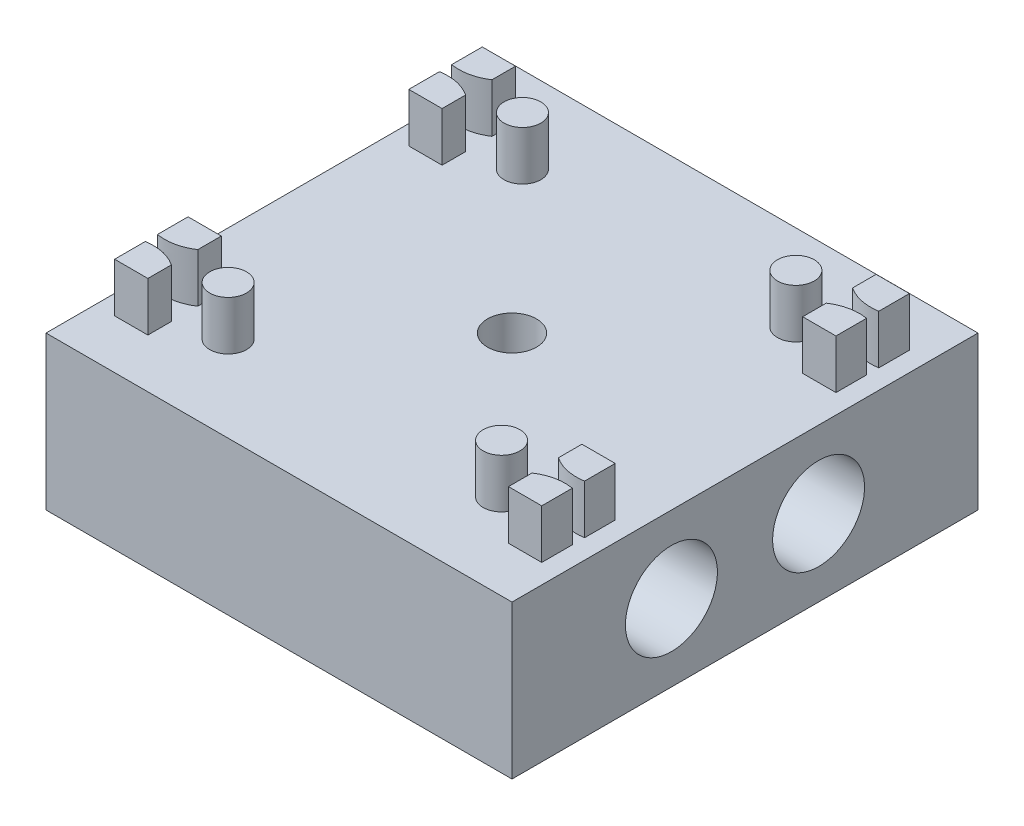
SolidWorks part; units mm, degrees
ref_plane "Piano frontale" through (0, 0, 0) normal (0, 0, 1) x (1, 0, 0)
ref_plane "Piano superiore" through (0, 0, 0) normal (0, 1, 0) x (1, 0, 0)
ref_plane "Piano destro" through (0, 0, 0) normal (1, 0, 0) x (0, 0, -1)
sketch "Schizzo2" plane through (0, 0, 0) normal (0, 1, 0) x (1, 0, 0)
  line L0 (13, 15) -> (13, -61) construction
  line L1 (-25, 15) -> (51, 15)
  line L2 (-25, 15) -> (-25, -61)
  line L3 (-25, -61) -> (51, -61)
  line L4 (51, 15) -> (51, -61)
  line L5 (-25, -23) -> (51, -23) construction
  circle A0 centre (13, -23) radius 4
  point P8 (0, 0)
  dimension "D2" = 76
  dimension "D4" = 76
extrude "Estrusione-Estrusione1" add sketch "Schizzo2" along normal blind 25
ref_plane "Piano2" through (0, 25, 0) normal (0, 1, 0) x (1, 0, 0)
sketch "Schizzo7" plane through (0, 25, 0) normal (0, 1, 0) x (1, 0, 0)
  line L0 (51, -23) -> (-25, -23) construction
  line L2 (-21.8313, 6.9818) -> (-16.4042, 6.9818)
  line L3 (-16.4042, 6.9818) -> (-16.4042, 3.1421)
  line L4 (-21.8313, 6.9818) -> (-21.8313, 1.9818)
  line L5 (-21.8313, -4.9982) -> (-21.8313, 0.0018)
  line L6 (-21.8313, -4.9982) -> (-16.4042, -4.9982)
  line L7 (-16.4042, -4.9982) -> (-16.4042, -1.1585)
  line L8 (42.4042, -4.9982) -> (42.4042, -1.1585)
  line L9 (47.8313, -4.9982) -> (42.4042, -4.9982)
  line L10 (47.8313, -4.9982) -> (47.8313, 0.0018)
  line L11 (47.8313, 6.9818) -> (47.8313, 1.9818)
  line L12 (42.4042, 6.9818) -> (42.4042, 3.1421)
  line L13 (47.8313, 6.9818) -> (42.4042, 6.9818)
  line L14 (47.8313, -52.9818) -> (47.8313, -47.9818)
  line L15 (47.8313, -41.0018) -> (47.8313, -46.0018)
  line L16 (47.8313, -52.9818) -> (42.4042, -52.9818)
  line L17 (42.4042, -52.9818) -> (42.4042, -49.1421)
  line L18 (47.8313, -41.0018) -> (42.4042, -41.0018)
  line L19 (42.4042, -41.0018) -> (42.4042, -44.8415)
  line L20 (-16.4042, -41.0018) -> (-16.4042, -44.8415)
  line L21 (-21.8313, -41.0018) -> (-16.4042, -41.0018)
  line L22 (-21.8313, -41.0018) -> (-21.8313, -46.0018)
  line L23 (-21.8313, -52.9818) -> (-21.8313, -47.9818)
  line L24 (-16.4042, -52.9818) -> (-16.4042, -49.1421)
  line L25 (-21.8313, -52.9818) -> (-16.4042, -52.9818)
  circle A0 centre (-9.2972, 1) radius 3
  circle A1 centre (35.2972, 1) radius 3
  circle A2 centre (35.2972, -47) radius 3
  circle A3 centre (-9.2972, -47) radius 3
  spline S0 degree 2 poles (-21.8313, 1.9818) (-18.8466, 1.5417) (-16.4042, 3.1421) knots 0 0 0 1 1 1
  spline S1 degree 2 poles (-21.8313, 0.0018) (-18.8466, 0.4419) (-16.4042, -1.1585) knots 0 0 0 1 1 1
  spline S2 degree 2 poles (47.8313, 0.0018) (44.8466, 0.4419) (42.4042, -1.1585) knots 0 0 0 1 1 1
  spline S3 degree 2 poles (47.8313, 1.9818) (44.8466, 1.5417) (42.4042, 3.1421) knots 0 0 0 1 1 1
  spline S4 degree 2 poles (47.8313, -47.9818) (44.8466, -47.5417) (42.4042, -49.1421) knots 0 0 0 1 1 1
  spline S5 degree 2 poles (47.8313, -46.0018) (44.8466, -46.4419) (42.4042, -44.8415) knots 0 0 0 1 1 1
  spline S6 degree 2 poles (-21.8313, -46.0018) (-18.8466, -46.4419) (-16.4042, -44.8415) knots 0 0 0 1 1 1
  spline S7 degree 2 poles (-21.8313, -47.9818) (-18.8466, -47.5417) (-16.4042, -49.1421) knots 0 0 0 1 1 1
  point P11 (-14.6072, -0.2521)
  point P27 (40.6072, -0.2521)
  point P52 (40.6072, -45.7479)
  point P53 (-14.6072, -45.7479)
  point P54 (0, 0)
  point P55 (0, 0)
extrude "Estrusione-Estrusione2" add sketch "Schizzo7" along normal blind 8
ref_plane "Piano3" through (-25, 0, 0) normal (-1, 0, 0) x (0, 0, 1)
sketch "Schizzo8" plane through (-25, 0, 0) normal (-1, 0, 0) x (0, 0, 1)
  line L0 (-15, 25) -> (61, 25) construction
  line L2 (61, 25) -> (61, 0) construction
  line L3 (11, 12.5) -> (35, 12.5) construction
  circle A0 centre (11, 12.5) radius 7.5
  circle A1 centre (35, 12.5) radius 7.5
  point P2 (23, 12.5)
  point P3 (61, 12.5)
  point P10 (23, 25)
  dimension "D1" = 24
  dimension "D3" = 15
  dimension "D4" = 15
extrude "Taglio-Estrusione1" cut sketch "Schizzo8" against normal blind 76
equation "\"x\"= 1mm"
equation "\"y\"= 1mm"
equation "\"z\"= 1mm"
